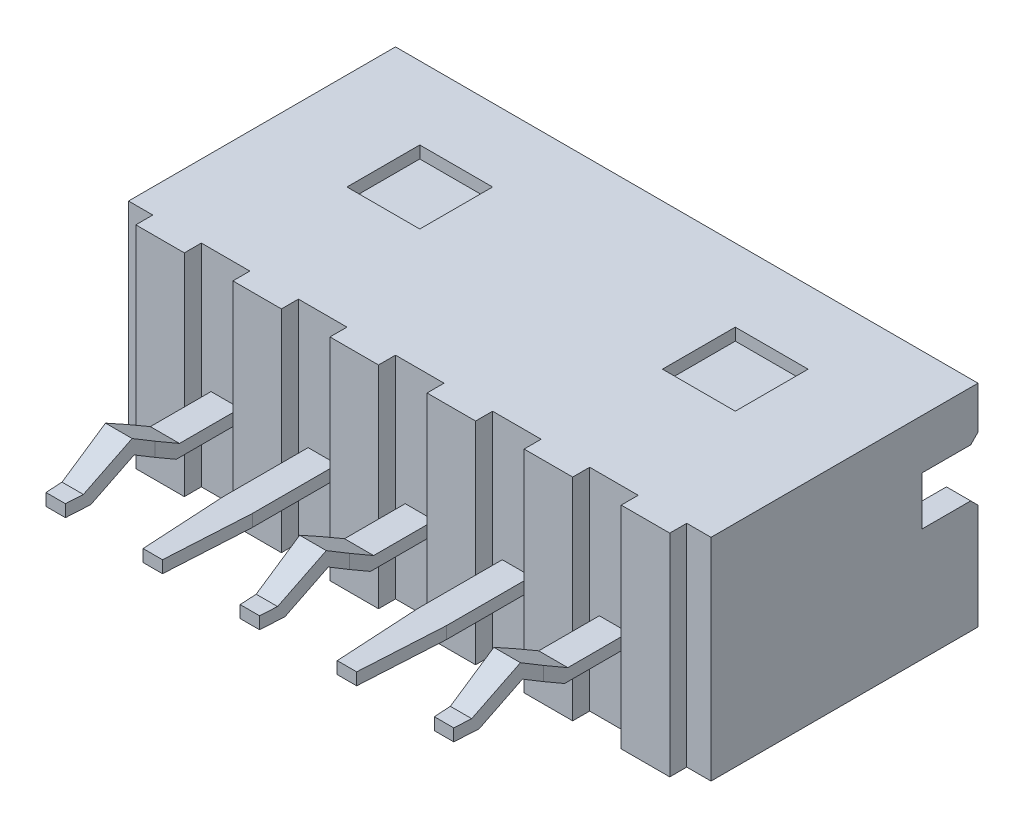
SolidWorks part; units mm, degrees
ref_plane "Front Plane" through (0, 0, 0) normal (0, 0, 1) x (1, 0, 0)
ref_plane "Top Plane" through (0, 0, 0) normal (0, 1, 0) x (1, 0, 0)
ref_plane "Right Plane" through (0, 0, 0) normal (1, 0, 0) x (0, 0, -1)
sketch "Sketch1" plane through (0, 0, 0) normal (0, 0, 1) x (1, 0, 0)
  line L0 (-5.5, 1.675) -> (-5.5, -1.175)
  line L1 (-6, 2.175) -> (6, 2.175)
  line L2 (-6, 2.175) -> (-6, -2.175)
  line L3 (-6, -2.175) -> (6, -2.175)
  line L4 (6, 2.175) -> (6, -2.175)
  line L5 (-5.5, -1.175) -> (-5.25, -1.175)
  line L6 (-5.25, -1.175) -> (-5, -1.675)
  line L7 (-5, -1.675) -> (5, -1.675)
  line L8 (5, -1.675) -> (5.25, -1.175)
  line L9 (-5.5, 1.675) -> (5.5, 1.675)
  line L10 (5.25, -1.175) -> (5.5, -1.175)
  line L11 (5.5, -1.175) -> (5.5, 1.675)
  line L12 (-5.5, 1.675) -> (-6, 1.675) construction
  line L13 (-5.5, -1.675) -> (-5.5, -2.175) construction
  line L14 (5.5, -1.675) -> (6, -1.675) construction
  line L15 (-5.5, 1.675) -> (-5.5, 2.175) construction
  point P4 (0, 2.175)
  point P6 (-6, 0)
  dimension "D1" = 4.35
  dimension "D2" = 12
  dimension "D3" = 0.5
  dimension "D4" = 0.5
  dimension "D5" = 0.25
  dimension "D6" = 0.5
extrude "Boss-Extrude1" add sketch "Sketch1" along normal blind 2.85
sketch "Sketch3" plane through (0, 0, 2.85) normal (0, 0, 1) x (1, 0, 0)
  line L1 (-6, 2.175) -> (6, 2.175)
  line L2 (-6, 2.175) -> (-6, -2.175)
  line L3 (-6, -2.175) -> (6, -2.175)
  line L4 (6, 2.175) -> (6, -2.175)
extrude "Boss-Extrude2" add sketch "Sketch3" along normal blind 2.65
sketch "Sketch4" plane through (0, 2.175, 0) normal (0, 1, 0) x (1, 0, 0)
  line L0 (6, -5.5) -> (-6, -5.5) construction
  line L1 (-5.5, -5.5) -> (-4.5, -5.5)
  line L2 (-5.5, -5.5) -> (-5.5, -5.85)
  line L3 (-5.5, -5.85) -> (-4.5, -5.85)
  line L4 (-4.5, -5.5) -> (-4.5, -5.85)
  line L5 (-6, -5.5) -> (-6, 0) construction
  line L6 (-3.5, -5.5) -> (-2.5, -5.5)
  line L7 (-3.5, -5.5) -> (-3.5, -5.85)
  line L8 (-3.5, -5.85) -> (-2.5, -5.85)
  line L9 (-2.5, -5.5) -> (-2.5, -5.85)
  line L10 (-1.5, -5.5) -> (-0.5, -5.5)
  line L11 (-1.5, -5.5) -> (-1.5, -5.85)
  line L12 (-1.5, -5.85) -> (-0.5, -5.85)
  line L13 (-0.5, -5.5) -> (-0.5, -5.85)
  line L14 (0.5, -5.5) -> (1.5, -5.5)
  line L15 (0.5, -5.5) -> (0.5, -5.85)
  line L16 (0.5, -5.85) -> (1.5, -5.85)
  line L17 (1.5, -5.5) -> (1.5, -5.85)
  line L18 (2.5, -5.5) -> (3.5, -5.5)
  line L19 (2.5, -5.5) -> (2.5, -5.85)
  line L20 (2.5, -5.85) -> (3.5, -5.85)
  line L21 (3.5, -5.5) -> (3.5, -5.85)
  line L22 (4.5, -5.5) -> (5.5, -5.5)
  line L23 (4.5, -5.5) -> (4.5, -5.85)
  line L24 (4.5, -5.85) -> (5.5, -5.85)
  line L25 (5.5, -5.5) -> (5.5, -5.85)
  point P30 (0, 0)
  dimension "D1" = 1
  dimension "D2" = 0.35
  dimension "D3" = 0.5
  dimension "D4" = 1
  dimension "D5" = 1
  dimension "D6" = 1
  dimension "D7" = 1
  dimension "D8" = 1
extrude "Boss-Extrude3" add sketch "Sketch4" against normal up to surface (4.35 mm away)
sketch "Sketch5" plane through (0, 0, 2.85) normal (0, 0, -1) x (-1, 0, 0)
  line L0 (-4.15, 0) -> (4.15, 0) construction
  line L1 (-4.15, 0.75) -> (-3.85, 0.75)
  line L2 (-4.15, 0.75) -> (-4.15, -0.75)
  line L3 (-4.15, -0.75) -> (-3.85, -0.75)
  line L4 (-3.85, 0.75) -> (-3.85, -0.75)
  line L5 (-2.15, 0.75) -> (-1.85, 0.75)
  line L6 (-2.15, 0.75) -> (-2.15, -0.75)
  line L7 (-2.15, -0.75) -> (-1.85, -0.75)
  line L8 (-1.85, 0.75) -> (-1.85, -0.75)
  line L9 (-0.15, 0.75) -> (0.15, 0.75)
  line L10 (-0.15, 0.75) -> (-0.15, -0.75)
  line L11 (-0.15, -0.75) -> (0.15, -0.75)
  line L12 (0.15, 0.75) -> (0.15, -0.75)
  line L13 (1.85, 0.75) -> (2.15, 0.75)
  line L14 (1.85, 0.75) -> (1.85, -0.75)
  line L15 (1.85, -0.75) -> (2.15, -0.75)
  line L16 (2.15, 0.75) -> (2.15, -0.75)
  line L17 (3.85, 0.75) -> (4.15, 0.75)
  line L18 (3.85, 0.75) -> (3.85, -0.75)
  line L19 (3.85, -0.75) -> (4.15, -0.75)
  line L20 (4.15, 0.75) -> (4.15, -0.75)
  point P22 (0, 0)
  dimension "D1" = 0.3
  dimension "D2" = 1.7
  dimension "D3" = 1.7
  dimension "D4" = 1.7
  dimension "D5" = 1.7
  dimension "D6" = 1.5
extrude "Boss-Extrude4" add sketch "Sketch5" along normal up to surface (2.85 mm away)
sketch "Sketch6" plane through (0, 2.175, 0) normal (0, 1, 0) x (1, 0, 0)
  line L0 (6, 0) -> (-6, 0) construction
  line L1 (-4, -1.5) -> (-2.5, -1.5)
  line L2 (-4, -1.5) -> (-4, -3)
  line L3 (-4, -3) -> (-2.5, -3)
  line L4 (-2.5, -1.5) -> (-2.5, -3)
  line L5 (2.5, -1.5) -> (4, -1.5)
  line L6 (2.5, -1.5) -> (2.5, -3)
  line L7 (2.5, -3) -> (4, -3)
  line L8 (4, -1.5) -> (4, -3)
  line L9 (-6, -5.5) -> (-6, 0) construction
  line L10 (6, -5.5) -> (6, 0) construction
  dimension "D1" = 1.5
  dimension "D2" = 1.5
  dimension "D3" = 2
  dimension "D4" = 2
extrude "Cut-Extrude1" cut sketch "Sketch6" against normal blind 0.25
sketch "Sketch7" plane through (6, 0, 0) normal (1, 0, 0) x (0, 0, -1)
  line L0 (0, 1.3) -> (-0.15, 1.15)
  line L1 (0, -2.175) -> (0, 2.175) construction
  line L2 (-0.15, 1.15) -> (-1.15, 1.15)
  line L3 (-1.15, 1.15) -> (-1.15, 0.15)
  line L4 (-1.15, 0.15) -> (-0.15, 0.15)
  line L5 (-0.15, 0.15) -> (0, 0)
  line L6 (0, 0) -> (0, 1.3)
  line L9 (-5.5, 2.175) -> (0, 2.175) construction
  dimension "D1" = 2.175
  dimension "D2" = 0.15
  dimension "D3" = 1
  dimension "D4" = 1
extrude "Cut-Extrude2" cut sketch "Sketch7" against normal blind 0.5
sketch "Sketch8" plane through (-6, 0, 0) normal (-1, 0, 0) x (0, 0, 1)
  line L0 (0, 1.3) -> (0.15, 1.15)
  line L1 (0.15, 1.15) -> (1.15, 1.15)
  line L2 (1.15, 1.15) -> (1.15, 0.15)
  line L3 (1.15, 0.15) -> (0.15, 0.15)
  line L4 (0.15, 0.15) -> (0, 0)
  line L5 (0, 2.175) -> (0, -2.175) construction
  line L6 (0, 0) -> (0, 1.3)
extrude "Cut-Extrude3" cut sketch "Sketch8" against normal blind 0.5
sketch "Sketch9" plane through (4.15, 0, 0) normal (1, 0, 0) x (0, 0, -1)
  line L0 (0, -2.175) -> (0, 0) construction
  line L1 (0, -0.75) -> (0, 0.75) construction
  line L3 (0, -0.75) -> (-2.85, -0.75) construction
  line L4 (0, 0.75) -> (-2.85, 0.75) construction
  line L5 (0, -0.5) -> (-2.1651, 0.75)
  line L6 (-2.1651, 0.75) -> (0, 0.75)
  line L7 (0, 0.75) -> (0, -0.5)
  dimension "D1" = 60
  dimension "D2" = 0.25
extrude "Cut-Extrude4" cut sketch "Sketch9" against normal up to surface (9.65 mm away)
chamfer "Chamfer6" distance 0.375 5 edges at (-4, 0.75, 2.1651) (-2, 0.75, 2.1651) (0, 0.75, 2.1651) (2, 0.75, 2.1651) (4, 0.75, 2.1651)
ref_plane "Plane1" through (0, -0.625, 0) normal (0, -1, 0) x (-1, 0, 0)
sketch "Sketch10" plane through (0, -0.625, 0) normal (0, -1, 0) x (-1, 0, 0)
  line L0 (3.5, -5.5) -> (4.5, -5.5) construction
  line L1 (4.3, -5.5) -> (3.7, -5.5)
  line L2 (4.3, -5.5) -> (4.3, -9)
  line L3 (4.3, -9) -> (3.7, -9)
  line L4 (3.7, -5.5) -> (3.7, -9)
  line L5 (1.5, -5.5) -> (2.5, -5.5) construction
  line L6 (2.3, -5.5) -> (1.7, -5.5)
  line L7 (2.3, -5.5) -> (2.3, -9)
  line L8 (2.3, -9) -> (1.7, -9)
  line L9 (1.7, -5.5) -> (1.7, -9)
  line L10 (-0.5, -5.5) -> (0.5, -5.5) construction
  line L11 (0.3, -5.5) -> (-0.3, -5.5)
  line L12 (0.3, -5.5) -> (0.3, -9)
  line L13 (0.3, -9) -> (-0.3, -9)
  line L14 (-0.3, -5.5) -> (-0.3, -9)
  line L15 (-2.5, -5.5) -> (-1.5, -5.5) construction
  line L16 (-1.7, -5.5) -> (-2.3, -5.5)
  line L17 (-1.7, -5.5) -> (-1.7, -9)
  line L18 (-1.7, -9) -> (-2.3, -9)
  line L19 (-2.3, -5.5) -> (-2.3, -9)
  line L20 (-4.5, -5.5) -> (-3.5, -5.5) construction
  line L21 (-3.7, -5.5) -> (-4.3, -5.5)
  line L22 (-3.7, -5.5) -> (-3.7, -9)
  line L23 (-3.7, -9) -> (-4.3, -9)
  line L24 (-4.3, -5.5) -> (-4.3, -9)
  point P30 (4, -5.5)
  point P31 (2, -5.5)
  point P32 (0, -5.5)
  point P33 (-2, -5.5)
  point P34 (-4, -5.5)
  dimension "D1" = 0.6
  dimension "D2" = 3.5
extrude "Boss-Extrude5" add sketch "Sketch10" against normal blind 0.8
sketch "Sketch13" plane through (-4.3, 0, 0) normal (-1, 0, 0) x (0, 0, 1)
  line L0 (9, -0.625) -> (5.5, -0.625)
  line L1 (5.5, -2.175) -> (5.5, 2.175) construction
  line L2 (5.5, 2.175) -> (5.5, -2.175) construction
  line L3 (5.5, -0.625) -> (5.5, 0.175)
  line L4 (9, 0.175) -> (5.5, 0.175) construction
  line L5 (5.5, 0.175) -> (9, 0.175)
  line L6 (9, 0.175) -> (9, -0.625)
  line L7 (9, -0.625) -> (9, -0.375)
  line L8 (9, -0.375) -> (8.65, -0.375)
  line L9 (8.65, -0.375) -> (7.7, 0.175)
  line L10 (7.7, 0.175) -> (6.75, -0.375)
  line L11 (6.75, -0.375) -> (5.5, -0.375)
  line L12 (5.5, -0.375) -> (5.5, -0.625)
  line L13 (6.8171, -0.625) -> (7.6612, -0.1363)
  line L14 (7.6612, -0.1363) -> (8.5053, -0.625)
  line L15 (8.5053, -0.625) -> (9, -0.625)
  line L16 (7.225, -0.1) -> (7.3503, -0.3164) construction
  line L17 (8.175, -0.1) -> (8.0303, -0.35) construction
  line L18 (5.5, -0.375) -> (5.5, -0.625)
  dimension "D1" = 0.25
  dimension "D3" = 0.25
  dimension "D4" = 0.25
  dimension "D5" = 0.35
  dimension "D6" = 1.25
extrude "Cut-Extrude7" cut sketch "Sketch13" against normal up to next contours L11 L10 L5 M14 | L14 L13 L0 | L9 L8 L6 M13
sketch "Sketch14" plane through (0.3, 0, 0) normal (1, 0, 0) x (0, 0, -1)
  line L0 (-9, -0.375) -> (-9, -0.625)
  line L1 (-9, -0.625) -> (-8.5053, -0.625)
  line L2 (-8.5053, -0.625) -> (-7.6612, -0.1363)
  line L3 (-7.6612, -0.1363) -> (-6.8171, -0.625)
  line L4 (-6.8171, -0.625) -> (-5.5, -0.625)
  line L5 (-5.5, -0.625) -> (-5.5, -0.375)
  line L6 (-5.5, -0.375) -> (-6.75, -0.375)
  line L7 (-6.75, -0.375) -> (-7.7, 0.175)
  line L8 (-7.7, 0.175) -> (-8.65, -0.375)
  line L9 (-8.65, -0.375) -> (-9, -0.375)
  line L11 (-9, 0.175) -> (-5.5, 0.175)
  line L12 (-9, 0.175) -> (-9, -0.625)
  line L13 (-9, -0.625) -> (-5.5, -0.625)
  line L14 (-5.5, 0.175) -> (-5.5, -0.625)
extrude "Cut-Extrude8" cut sketch "Sketch14" against normal up to next contours L9 L8 M3 M4 | L7 L6 M2 M3 | L3 L2 M1
sketch "Sketch15" plane through (4.3, 0, 0) normal (1, 0, 0) x (0, 0, -1)
  line L0 (-9, -0.375) -> (-9, -0.625)
  line L1 (-9, -0.625) -> (-8.5053, -0.625)
  line L2 (-8.5053, -0.625) -> (-7.6612, -0.1363)
  line L3 (-7.6612, -0.1363) -> (-6.8171, -0.625)
  line L4 (-6.8171, -0.625) -> (-5.5, -0.625)
  line L5 (-5.5, -0.625) -> (-5.5, -0.375)
  line L6 (-5.5, -0.375) -> (-6.75, -0.375)
  line L7 (-6.75, -0.375) -> (-7.7, 0.175)
  line L8 (-7.7, 0.175) -> (-8.65, -0.375)
  line L9 (-8.65, -0.375) -> (-9, -0.375)
  line L11 (-9, 0.175) -> (-5.5, 0.175)
  line L12 (-9, 0.175) -> (-9, -0.625)
  line L13 (-9, -0.625) -> (-5.5, -0.625)
  line L14 (-5.5, 0.175) -> (-5.5, -0.625)
extrude "Cut-Extrude9" cut sketch "Sketch15" against normal up to next contours L9 L8 M3 M4 | L7 L6 M2 M3 | L3 L2 M1
sketch "Sketch16" plane through (-1.7, 0, 0) normal (1, 0, 0) x (0, 0, -1)
  line L0 (-5.5, 0.175) -> (-5.5, -0.625) construction
  line L1 (-9, 0.175) -> (-5.5, 0.175)
  line L2 (-9, 0.175) -> (-9, -0.375)
  line L3 (-9, -0.375) -> (-5.5, -0.375)
  line L4 (-5.5, 0.175) -> (-5.5, -0.375)
  line L5 (-5.5, -0.625) -> (-9, -0.625) construction
  dimension "D1" = 0.25
extrude "Cut-Extrude10" cut sketch "Sketch16" against normal up to next
sketch "Sketch17" plane through (2.3, 0, 0) normal (1, 0, 0) x (0, 0, -1)
  line L0 (-5.5, 0.175) -> (-5.5, -0.625) construction
  line L1 (-9, 0.175) -> (-5.5, 0.175)
  line L2 (-9, 0.175) -> (-9, -0.375)
  line L3 (-9, -0.375) -> (-5.5, -0.375)
  line L4 (-5.5, 0.175) -> (-5.5, -0.375)
  line L5 (-5.5, -0.625) -> (-9, -0.625) construction
  dimension "D1" = 0.25
extrude "Cut-Extrude11" cut sketch "Sketch17" against normal up to next
ref_plane "Plane3" through (0, -0.375, 0) normal (0, 1, 0) x (1, 0, 0)
sketch "Sketch18" plane through (0, -0.375, 0) normal (0, 1, 0) x (1, 0, 0)
  line L0 (-2.3, -7.25) -> (-2.2, -9)
  line L1 (-2.3, -9) -> (-2.3, -5.5) construction
  line L2 (-2.3, -9) -> (-1.7, -9) construction
  line L3 (-2.3, -7.25) -> (-3.7, -7.25)
  line L5 (-1.7, -7.25) -> (-0.3, -7.25)
  line L6 (-1.7, -9) -> (-1.7, -5.5) construction
  line L7 (-0.3, -6.75) -> (-0.3, -7.7) construction
  line L8 (0.3, -7.25) -> (1.7, -7.25)
  line L9 (0.3, -6.75) -> (0.3, -7.7) construction
  line L10 (1.7, -9) -> (1.7, -5.5) construction
  line L11 (2.3, -7.25) -> (3.7, -7.25)
  line L12 (2.3, -9) -> (2.3, -5.5) construction
  line L13 (3.7, -6.75) -> (3.7, -7.7) construction
  line L14 (-1.7, -7.25) -> (-1.8, -9)
  line L15 (-1.8, -9) -> (-2.2, -9)
  line L17 (-0.3, -7.25) -> (-0.2, -9)
  line L18 (-0.3, -9) -> (0.3, -9) construction
  line L19 (-0.2, -9) -> (0.2, -9)
  line L20 (0.2, -9) -> (0.3, -7.25)
  line L21 (1.7, -7.25) -> (1.8, -9)
  line L22 (1.7, -9) -> (2.3, -9) construction
  line L23 (1.8, -9) -> (2.2, -9)
  line L24 (2.2, -9) -> (2.3, -7.25)
  line L25 (3.7, -7.25) -> (3.8, -9)
  line L26 (3.7, -9) -> (4.3, -9) construction
  line L27 (3.8, -9) -> (4.2, -9)
  line L28 (4.2, -9) -> (4.3, -7.25)
  line L30 (4.3, -7.25) -> (4.3, -9.1)
  line L31 (-3.7, -7.25) -> (-3.8, -9)
  line L32 (-3.7, -9) -> (-4.3, -9) construction
  line L33 (-3.8, -9) -> (-4.2, -9)
  line L34 (-4.2, -9) -> (-4.3, -7.25)
  line L36 (-4.3, -7.25) -> (-4.3, -9.1)
  line L37 (-4.3, -9.1) -> (4.3, -9.1)
  line L38 (-4.3, -7.7) -> (-4.3, -6.75) construction
  line L39 (-3.7, -7.7) -> (-3.7, -6.75) construction
  line L40 (4.3, -6.75) -> (4.3, -7.7) construction
  dimension "D1" = 0.1
  dimension "D2" = 0.1
extrude "Cut-Extrude12" cut sketch "Sketch18" against normal up to next and the other way up to next
